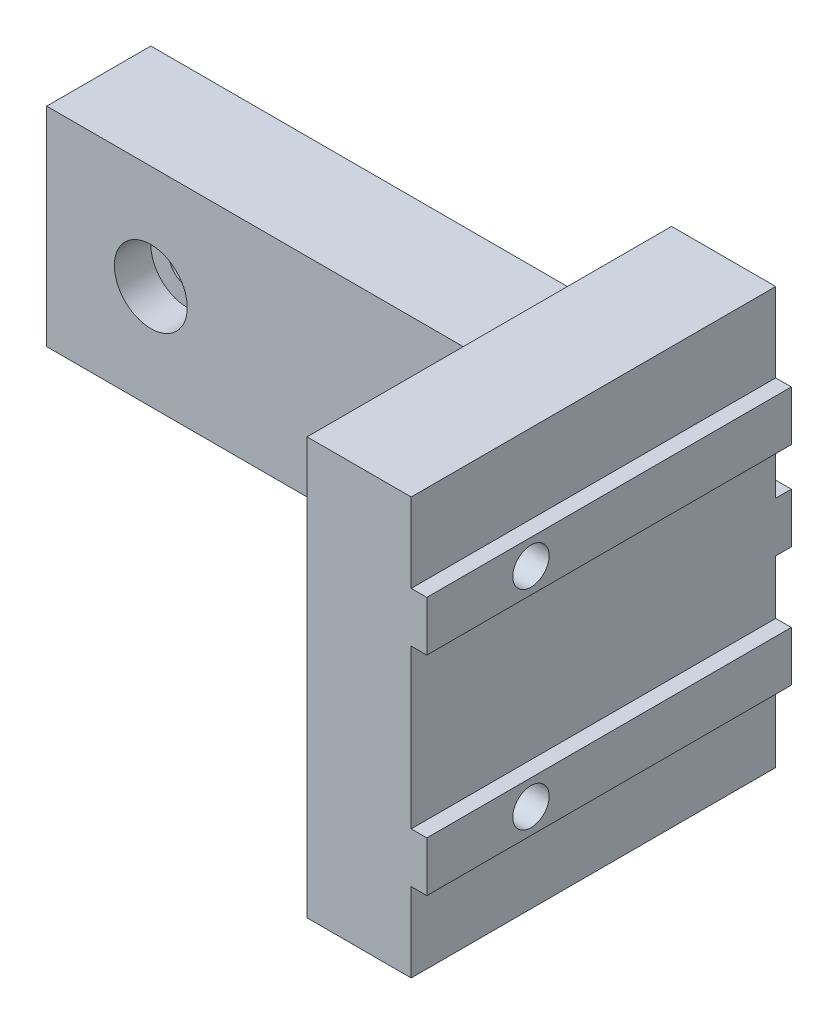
SolidWorks part; units mm, degrees
ref_plane "Ebene vorne" through (0, 0, 0) normal (0, 0, 1) x (1, 0, 0)
ref_plane "Ebene oben" through (0, 0, 0) normal (0, 1, 0) x (1, 0, 0)
ref_plane "Ebene rechts" through (0, 0, 0) normal (1, 0, 0) x (0, 0, -1)
sketch "Skizze1" plane through (0, 0, 0) normal (0, 1, 0) x (1, 0, 0)
  line L0 (-60, 0) -> (0, 0)
  line L1 (0, 0) -> (0, -35)
  line L2 (0, -35) -> (-10, -35)
  line L4 (-60, -10) -> (-60, 0)
  line L5 (-60, -10) -> (-20, -10)
  line L6 (-20, -10) -> (-10, -20)
  line L7 (-10, -20) -> (-10, -35)
  dimension "D1" = 60
  dimension "D2" = 10
  dimension "D3" = 10
  dimension "D4" = 35
  dimension "D5" = 10
extrude "Aufsatz-Linear austragen1" add sketch "Skizze1" along normal mid plane 20
sketch "Skizze2" plane through (0, 0, 0) normal (0, 1, 0) x (1, 0, 0)
  line L0 (0, 0) -> (-60, 0)
  line L1 (-60, 0) -> (-60, 1.5)
  line L2 (-60, 1.5) -> (0, 1.5)
  line L6 (0, 0) -> (0, 1.5)
  dimension "D1" = 1.5
extrude "Aufsatz-Linear austragen2" add sketch "Skizze2" along normal mid plane 4.8
sketch "Skizze10" plane through (0, 0, 35) normal (0, 0, 1) x (1, 0, 0)
  line L1 (0, 10) -> (-10, 10)
  line L2 (0, 10) -> (0, 20)
  line L3 (0, 20) -> (-10, 20)
  line L4 (-10, 10) -> (-10, 20)
  line L5 (0, -10) -> (-10, -10)
  line L6 (0, -10) -> (0, -20)
  line L7 (0, -20) -> (-10, -20)
  line L8 (-10, -10) -> (-10, -20)
  point P10 (-10, -10)
  point P12 (-10, 10)
  dimension "D1" = 40
extrude "Aufsatz-Linear austragen4" add sketch "Skizze10" against normal up to surface (35 mm away)
chamfer "Fase1" distance 10 angle 45 2 edges at (-10, -10, 10) (-10, 10, 10)
sketch "Skizze11" plane through (0, 0, 0) normal (1, 0, 0) x (0, 0, -1)
  line L0 (-35, 20) -> (-35, -20) construction
  line L1 (-35, 12.4) -> (0, 12.4)
  line L2 (-35, 12.4) -> (-35, 7.6)
  line L3 (-35, 7.6) -> (0, 7.6)
  line L4 (0, 12.4) -> (0, 7.6)
  line L5 (0, 20) -> (0, 2.4) construction
  line L6 (0, -2.4) -> (0, -20) construction
  line L7 (-35, -7.6) -> (0, -7.6)
  line L8 (-35, -7.6) -> (-35, -12.4)
  line L9 (-35, -12.4) -> (0, -12.4)
  line L10 (0, -7.6) -> (0, -12.4)
  line L11 (0, 20) -> (-35, 20) construction
  line L12 (0, -20) -> (-35, -20) construction
  point P14 (0, 10)
  point P19 (0, -10)
  dimension "D1" = 10
  dimension "D2" = 10
  dimension "D3" = 4.8
extrude "Aufsatz-Linear austragen5" add sketch "Skizze11" along normal blind 1.5
hole_wizard "Ø3.5 (3.5) Durchmesser Bohrung1" positions "Skizze3" profile "Skizze4" hole size "Ø3.5" standard "DIN"
sketch "Skizze3" plane through (1.5, 0, 0) normal (1, 0, 0) x (0, 0, -1)
  line L1 (-35, 12.4) -> (-35, 7.6) construction
  line L2 (-35, 10) -> (-25, 10) construction
  line L3 (-35, -10) -> (-25, -10) construction
  line L4 (-35, -7.6) -> (-35, -12.4) construction
  point P0 (-25, 10)
  point P19 (-25, -10)
  dimension "D1" = 10
sketch "Skizze4" plane through (1.5, 10, 25) normal (0, 1, 0) x (0, 0, -1)
  line L0 (0, 0) -> (0, 61.5)
  line L1 (0, 61.5) -> (1.75, 61.5)
  line L2 (1.75, 61.5) -> (1.75, 0)
  line L5 (1.75, 0) -> (0, 0)
  line L11 (0, -6.35) -> (0, 107.95) construction
  dimension "Bohrerdurchmesser" = 3.5
  dimension "Bohrungstiefe" = 61.5
hole_wizard "Ø3.5 (3.5) Durchmesser Bohrung2" positions "Skizze5" profile "Skizze6" hole size "Ø3.5" standard "DIN"
sketch "Skizze5" plane through (0, 0, -1.5) normal (0, 0, -1) x (-1, 0, 0)
  line L0 (60, 2.4) -> (60, -2.4) construction
  point P0 (50, 0)
  point P2 (25, 0)
  dimension "D1" = 10
  dimension "D2" = 25
sketch "Skizze6" plane through (-50, 0, -1.5) normal (1, 0, 0) x (0, 1, 0)
  line L0 (0, 0) -> (0, 36.5)
  line L1 (0, 36.5) -> (1.75, 36.5)
  line L2 (1.75, 36.5) -> (1.75, 0)
  line L5 (1.75, 0) -> (0, 0)
  line L11 (0, -6.35) -> (0, 107.95) construction
  dimension "Bohrerdurchmesser" = 3.5
  dimension "Bohrungstiefe" = 36.5
ref_plane "Ebene1" through (-6.5, 0, 0) normal (1, 0, 0) x (0, 0, -1)
ref_plane "Ebene2" through (0, 0, 6.5) normal (0, 0, -1) x (-1, 0, 0)
sketch "Skizze7" plane through (-6.5, 0, 0) normal (1, 0, 0) x (0, 0, -1)
  circle A0 centre (-25, 10) radius 3.5
  circle A2 centre (-25, -10) radius 3.5
  dimension "D1" = 7
extrude "Schnitt-Linear austragen1" cut sketch "Skizze7" against normal through all
sketch "Skizze8" plane through (0, 0, 6.5) normal (0, 0, -1) x (-1, 0, 0)
  circle A0 centre (25, 0) radius 3.5
  circle A1 centre (50, 0) radius 3.5
  dimension "D1" = 7
extrude "Schnitt-Linear austragen2" cut sketch "Skizze8" against normal through all
